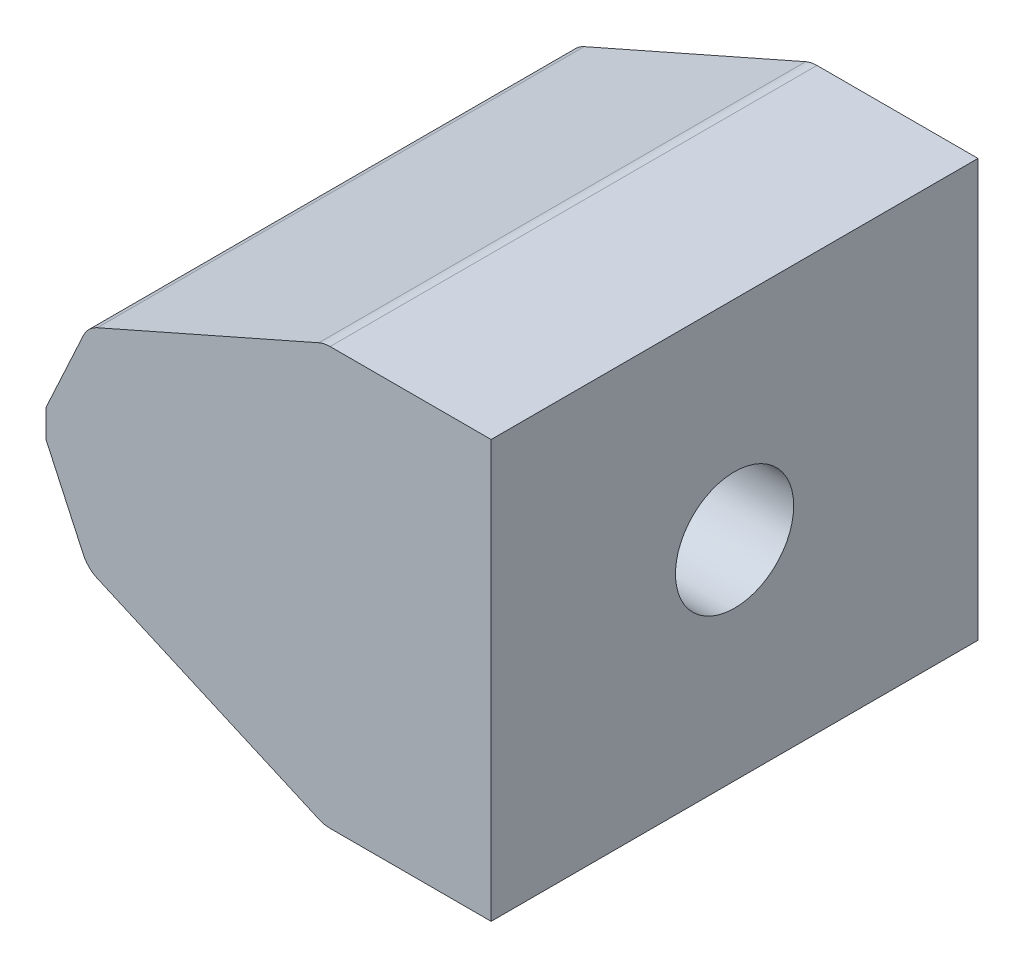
SolidWorks part; units mm, degrees
ref_plane "Plan de face" through (0, 0, 0) normal (0, 0, 1) x (1, 0, 0)
ref_plane "Plan de dessus" through (0, 0, 0) normal (0, 1, 0) x (1, 0, 0)
ref_plane "Plan de droite" through (0, 0, 0) normal (1, 0, 0) x (0, 0, -1)
sketch "Esquisse1" plane through (0, 0, 0) normal (0, 0, 1) x (1, 0, 0)
  line L0 (0, -1) -> (0, 1)
  line L1 (0, 1) -> (2.6831, 6.8135)
  line L2 (3.6918, 7.8052) -> (19.6143, 14.8298)
  line L3 (20.4216, 15) -> (32, 15)
  line L4 (32, 15) -> (32, -15)
  line L5 (-12.2424, 0) -> (83.5105, 0) construction
  line L6 (20.4216, -15) -> (32, -15)
  line L7 (3.6918, -7.8052) -> (19.6143, -14.8298)
  line L8 (0, -1) -> (2.6831, -6.8135)
  arc A0 (2.6831, 6.8135) -> (3.6918, 7.8052) centre (4.4991, 5.9754) cw
  arc A1 (19.6143, 14.8298) -> (20.4216, 15) centre (20.4216, 13) cw
  arc A2 (3.6918, -7.8052) -> (2.6831, -6.8135) centre (4.4991, -5.9754) cw
  arc A3 (20.4216, -15) -> (19.6143, -14.8298) centre (20.4216, -13) cw
  point P10 (32, 0)
  point P13 (0, 0)
  point P15 (3, 7.5)
  point P18 (20, 15)
  point P21 (3, -7.5)
  point P24 (20, -15)
  dimension "D7" = 2
  dimension "D1" = 20
  dimension "D2" = 30
  dimension "D3" = 2
  dimension "D4" = 15
  dimension "D5" = 3
  dimension "D6" = 32
extrude "Extrusion1" add sketch "Esquisse1" along normal mid plane 35
hole_wizard "Trou taraudé M10x1.51" positions "Esquisse3" profile "Esquisse2" tap size "M10x1.5" standard "ISO"
sketch "Esquisse3" plane through (32, 0, 0) normal (1, 0, 0) x (0, 0, -1)
  point P0 (0, 0)
sketch "Esquisse2" plane through (32, 0, 0) normal (0, 1, 0) x (0, 0, -1)
  line L0 (0, 0) -> (0, 32.5537)
  line L1 (0, 32.5537) -> (4.25, 30)
  line L2 (4.25, 30) -> (4.25, 0)
  line L5 (4.25, 0) -> (0, 0)
  line L10 (0, 32.5537) -> (-4.25, 30) construction
  line L11 (0, -6.35) -> (0, 107.95) construction
  dimension "Diamètre du trou pour taraudage" = 8.5
  dimension "Profondeur du trou pour taraudage" = 30
  dimension "Angle de pointe" = 118
